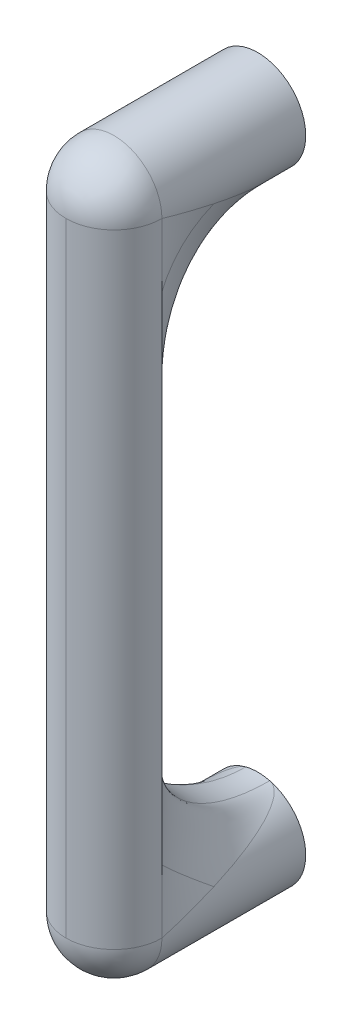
SolidWorks part; units mm, degrees
ref_plane "Alzado" through (0, 0, 0) normal (0, 0, 1) x (1, 0, 0)
ref_plane "Planta" through (0, 0, 0) normal (0, 1, 0) x (1, 0, 0)
ref_plane "Vista lateral" through (0, 0, 0) normal (1, 0, 0) x (0, 0, -1)
sketch "Sketch1" plane through (0, 0, 0) normal (0, 0, 1) x (1, 0, 0)
  line L0 (0, 65) -> (0, -65) construction
  circle A0 centre (0, 65) radius 10
  circle A1 centre (0, -65) radius 10
  circle A2 centre (0, 65) radius 2.5
  circle A3 centre (0, -65) radius 2.5
  dimension "D2" = 5
  dimension "D3" = 20
  dimension "D1" = 130
extrude "Boss-Extrude1" add sketch "Sketch1" along normal blind 30
sketch "Sketch2" plane through (0, 0, 30) normal (0, 0, 1) x (1, 0, 0)
  line L0 (-10, 65) -> (-10, -65)
  line L1 (10, -65) -> (10, 65)
  circle A0 centre (0, 65) radius 10 construction
  circle A1 centre (0, -65) radius 10 construction
  arc A2 (-10, -65) -> (10, -65) centre (0, -65) ccw
  arc A3 (10, 65) -> (-10, 65) centre (0, 65) ccw
extrude "Boss-Extrude2" add sketch "Sketch2" along normal blind 10
fillet "Fillet1" radius 10 4 edges at (10, 0, 40) (-10, 0, 40) (0, -75, 40) (0, 75, 40)
fillet "Fillet2" radius 30 2 edges at (0, -55, 30) (0, 55, 30)
